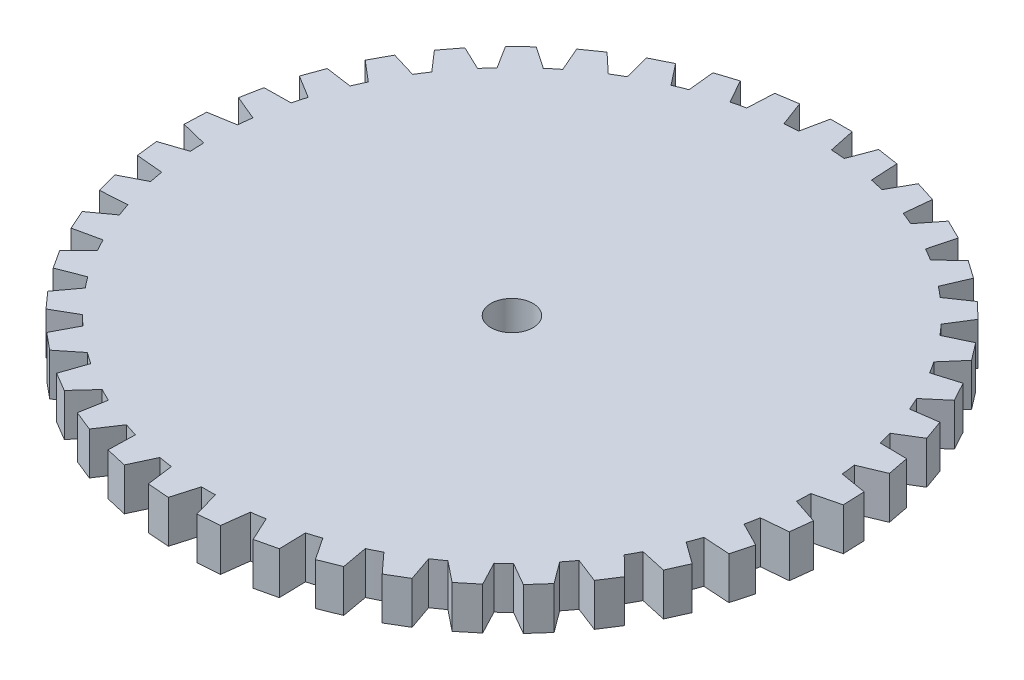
SolidWorks part; units mm, degrees
ref_plane "Front Plane" through (0, 0, 0) normal (0, 0, 1) x (1, 0, 0)
ref_plane "Top Plane" through (0, 0, 0) normal (0, 1, 0) x (1, 0, 0)
ref_plane "Right Plane" through (0, 0, 0) normal (1, 0, 0) x (0, 0, -1)
sketch "Sketch2" plane through (0, 0, 0) normal (0, 1, 0) x (1, 0, 0)
  circle A0 centre (0, 0) radius 10.6
  circle A1 centre (0, 0) radius 0.735
  point P6 (0.0833, 10.4097)
  dimension "D1" = 21.2
  dimension "D2" = 1.47
extrude "Boss-Extrude3" add sketch "Sketch2" along normal blind 1.48
sketch "Sketch3" plane through (0, 1.48, 0) normal (0, 1, 0) x (1, 0, 0)
  line L0 (-0.38, 11.5) -> (0.38, 11.5)
  line L1 (0.38, 11.5) -> (0.9, 9)
  line L2 (0.9, 9) -> (-0.9, 9)
  line L3 (-0.9, 9) -> (-0.38, 11.5)
  circle A1 centre (0, 0) radius 10.6 construction
  point P4 (0, 11.5)
  point P5 (0, 9)
  dimension "D1" = 0.76
  dimension "D2" = 1.8
  dimension "D3" = 9
  dimension "D4" = 2.5
extrude "Boss-Extrude4" add sketch "Sketch3" against normal up to surface (1.48 mm away)
pattern_circular "CirPattern11" count 41 over 360 about axis through (0, 0, 0) along (0, 1, 0) of "Boss-Extrude4"
